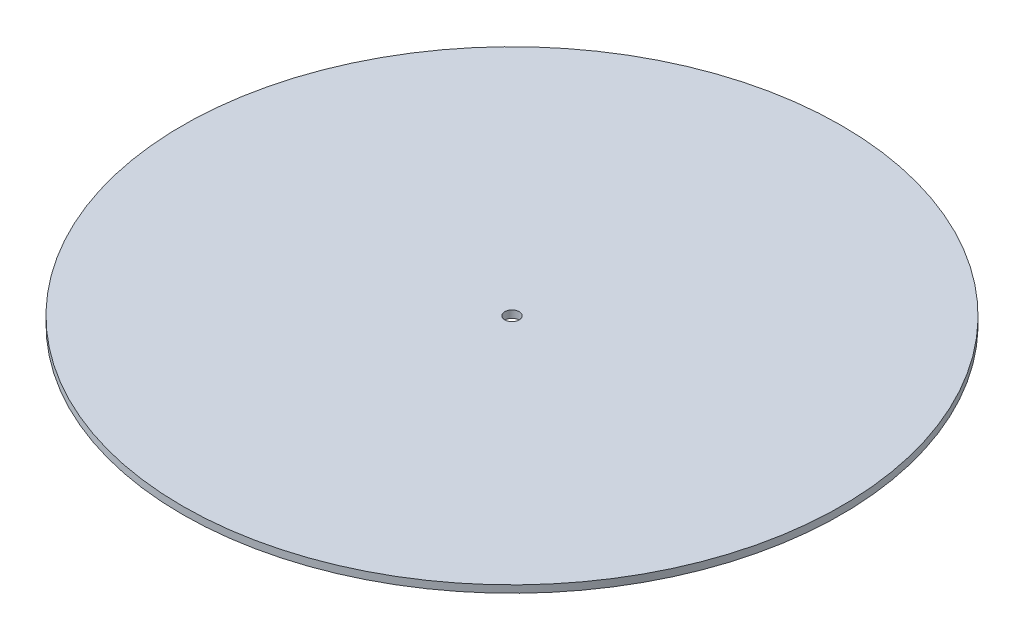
SolidWorks part; units mm, degrees
ref_plane "Front Plane" through (0, 0, 0) normal (0, 0, 1) x (1, 0, 0)
ref_plane "Top Plane" through (0, 0, 0) normal (0, 1, 0) x (1, 0, 0)
ref_plane "Right Plane" through (0, 0, 0) normal (1, 0, 0) x (0, 0, -1)
sketch "Sketch1" plane through (0, 0, 0) normal (0, 1, 0) x (1, 0, 0)
  circle A0 centre (0, 0) radius 114.7445
  circle A1 centre (0, 0) radius 2.5
  dimension "D1" = 229.489
  dimension "D2" = 5
extrude "Boss-Extrude1" add sketch "Sketch1" along normal blind 2.54 contours A0
